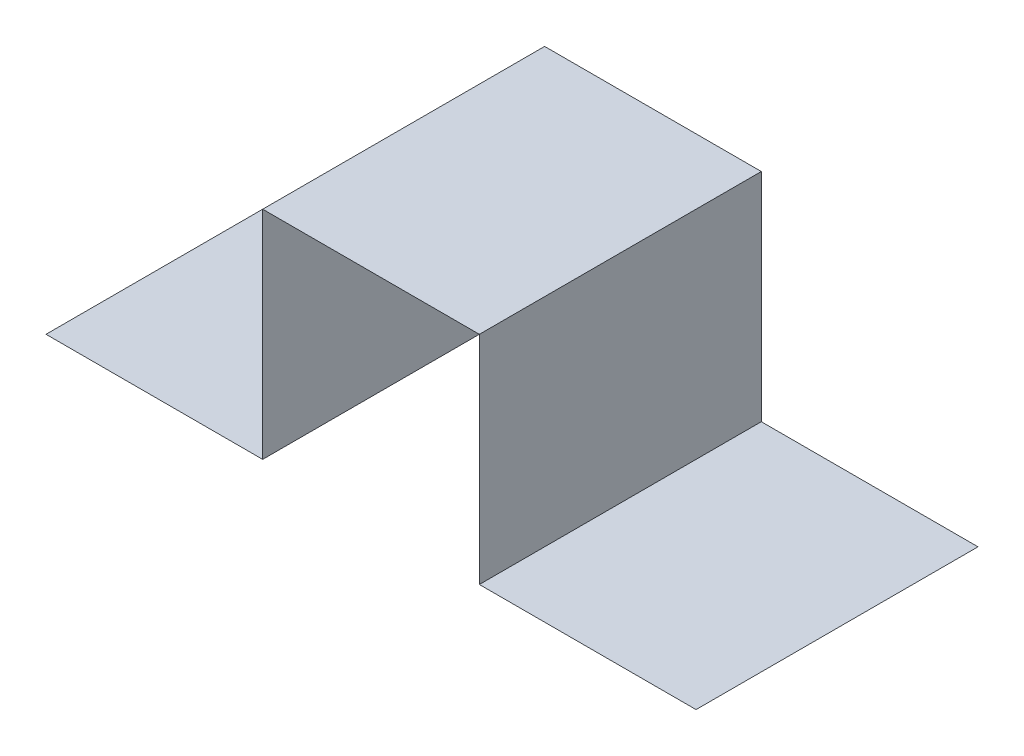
SolidWorks part; units mm, degrees
ref_plane "Front" through (0, 0, 0) normal (0, 0, 1) x (1, 0, 0)
ref_plane "Top" through (0, 0, 0) normal (0, 1, 0) x (1, 0, 0)
ref_plane "Right" through (0, 0, 0) normal (1, 0, 0) x (0, 0, -1)
sketch "Sketch1" plane through (0, 0, 0) normal (0, 0, 1) x (1, 0, 0)
  line L0 (0, 0) -> (41.5, 0)
  line L1 (41.5, 0) -> (41.5, 41.5)
  line L2 (41.5, 41.5) -> (83, 41.5)
  line L3 (83, 41.5) -> (83, 0)
  line L4 (83, 0) -> (124.5, 0)
  dimension "D1" = 41.5
surface "Surface-Extrude1" sketch "Sketch1" parameters "D1"=54
